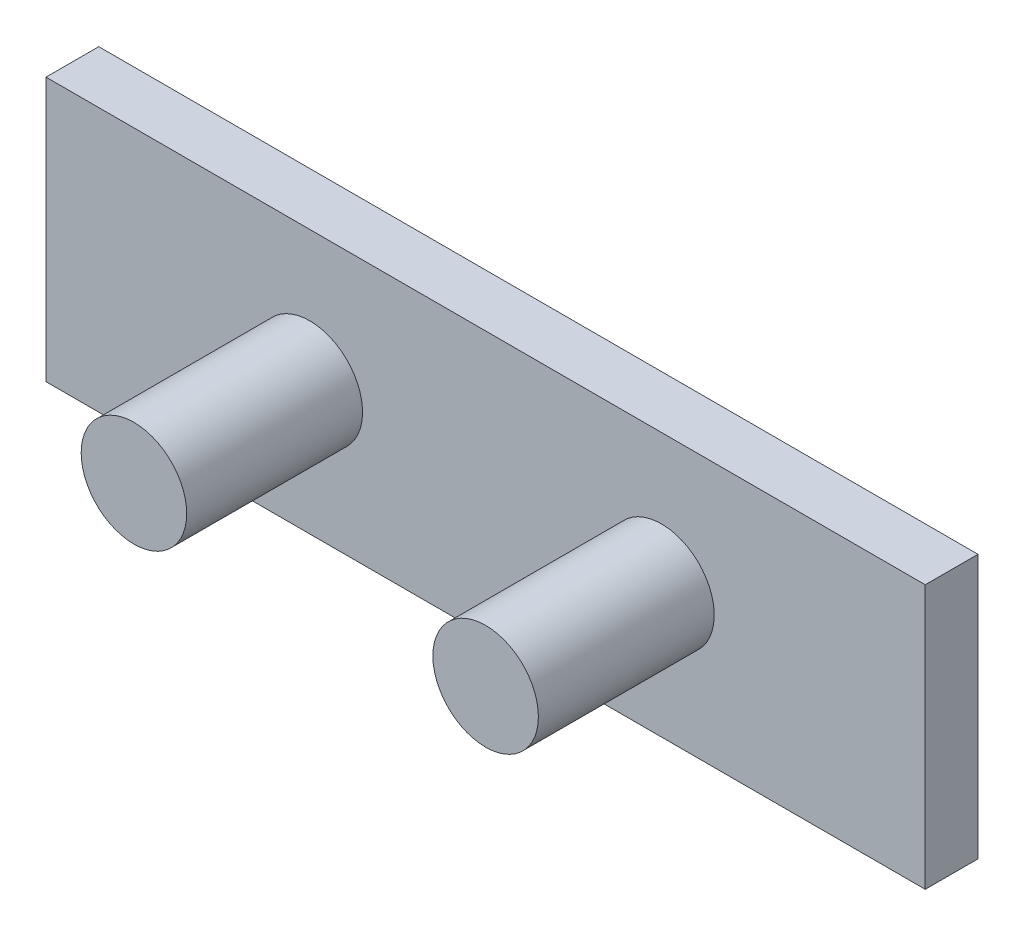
SolidWorks part; units mm, degrees
ref_plane "Vorne" through (0, 0, 0) normal (0, 0, 1) x (1, 0, 0)
ref_plane "Oben" through (0, 0, 0) normal (0, 1, 0) x (1, 0, 0)
ref_plane "Rechts" through (0, 0, 0) normal (1, 0, 0) x (0, 0, -1)
sketch "Skizze1" plane through (0, 0, 0) normal (0, 0, 1) x (1, 0, 0)
  line L1 (0, 0) -> (50, 0)
  line L2 (0, 0) -> (0, 15)
  line L3 (0, 15) -> (50, 15)
  line L4 (50, 0) -> (50, 15)
  dimension "D1" = 15
  dimension "D2" = 50
extrude "Linear austragen1" add sketch "Skizze1" along normal blind 3
sketch "Skizze2" plane through (0, 0, 3) normal (0, 0, 1) x (1, 0, 0)
  line L0 (-1000, 7.5) -> (49000, 7.5) construction
  line L1 (0, 15) -> (0, 0) construction
  line L2 (25, -985) -> (25, 49015) construction
  line L3 (50, 15) -> (0, 15) construction
  circle A0 centre (15, 7.5) radius 3
  circle A1 centre (35, 7.5) radius 3
  point P5 (0, 7.5)
  point P14 (25, 15)
  dimension "D1" = 6
  dimension "D2" = 20
extrude "Linear austragen2" add sketch "Skizze2" along normal blind 10
